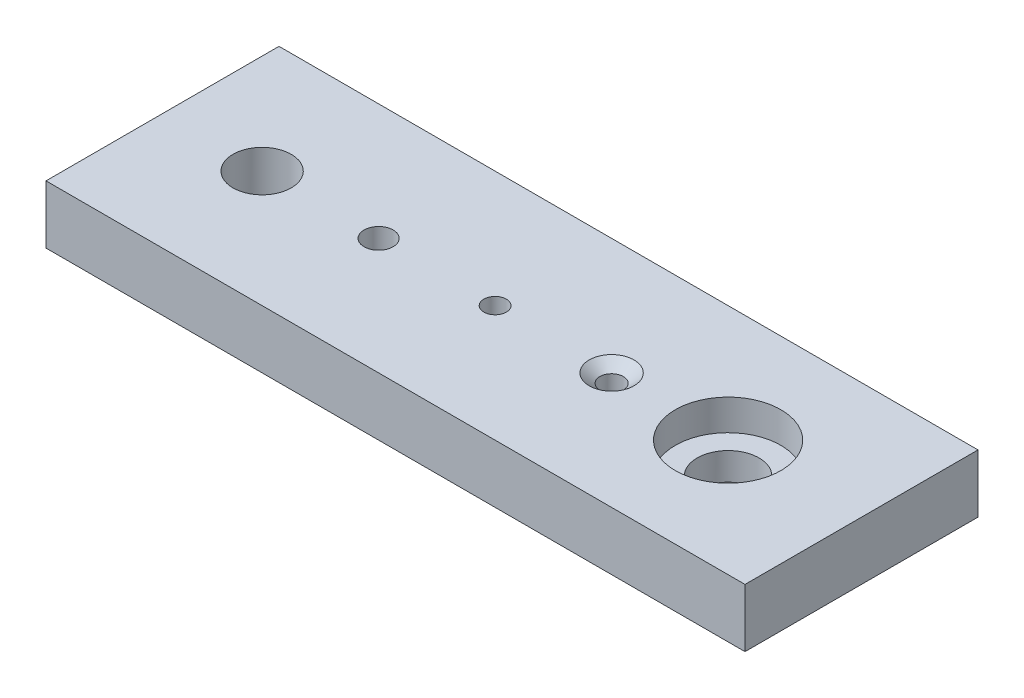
SolidWorks part; units mm, degrees
ref_plane "Front Plane" through (0, 0, 0) normal (0, 0, 1) x (1, 0, 0)
ref_plane "Top Plane" through (0, 0, 0) normal (0, 1, 0) x (1, 0, 0)
ref_plane "Right Plane" through (0, 0, 0) normal (1, 0, 0) x (0, 0, -1)
sketch "Sketch1" plane through (0, 0, 0) normal (0, 1, 0) x (1, 0, 0)
  line L1 (0, 0) -> (152.4, 0)
  line L2 (0, 0) -> (0, 50.8)
  line L3 (0, 50.8) -> (152.4, 50.8)
  line L4 (152.4, 0) -> (152.4, 50.8)
  dimension "D1" = 152.4
  dimension "D2" = 50.8
extrude "Boss-Extrude1" add sketch "Sketch1" along normal blind 12.7
hole_wizard "1/2 (0.5) Diameter Hole1" positions "Sketch3" profile "Sketch2" hole size "1/2" standard "ANSI Inch"
sketch "Sketch3" plane through (0, 12.7, 0) normal (0, 1, 0) x (1, 0, 0)
  line L0 (152.4, 50.8) -> (0, 50.8) construction
  line L1 (0, 50.8) -> (0, 0) construction
  point P0 (21.717, 25.4)
  dimension "D1" = 25.4
  dimension "D2" = 21.717
sketch "Sketch2" plane through (21.717, 12.7, -25.4) normal (1, 0, 0) x (0, 0, 1)
  line L0 (0, 0) -> (0, 12.7)
  line L1 (0, 12.7) -> (6.35, 12.7)
  line L2 (6.35, 12.7) -> (6.35, 0)
  line L5 (6.35, 0) -> (0, 0)
  line L11 (0, -6.35) -> (0, 107.95) construction
  dimension "Thru Hole Dia." = 12.7
  dimension "Thru Hole Depth" = 12.7
hole_wizard "1/4 (0.25) Diameter Hole1" positions "Sketch5" profile "Sketch4" hole size "1/4" standard "ANSI Inch"
sketch "Sketch5" plane through (0, 12.7, 0) normal (0, 1, 0) x (1, 0, 0)
  line L0 (152.4, 50.8) -> (0, 50.8) construction
  circle A0 centre (21.717, 25.4) radius 6.35 construction
  point P0 (47.117, 25.4)
  dimension "D1" = 25.4
  dimension "D2" = 25.4
sketch "Sketch4" plane through (47.117, 12.7, -25.4) normal (1, 0, 0) x (0, 0, 1)
  line L0 (0, 0) -> (0, 40.0077)
  line L1 (0, 40.0077) -> (3.175, 38.1)
  line L2 (3.175, 38.1) -> (3.175, 0)
  line L5 (3.175, 0) -> (0, 0)
  line L10 (0, 40.0077) -> (-3.175, 38.1) construction
  line L11 (0, -6.35) -> (0, 107.95) construction
  dimension "Hole Dia." = 6.35
  dimension "Hole Depth" = 38.1
  dimension "Drill Angle" = 118
hole_wizard "#10 (0.1935) Diameter Hole1" positions "Sketch7" profile "Sketch6" hole size "#10" standard "ANSI Inch"
sketch "Sketch7" plane through (0, 12.7, 0) normal (0, 1, 0) x (1, 0, 0)
  line L0 (152.4, 50.8) -> (0, 50.8) construction
  circle A0 centre (47.117, 25.4) radius 3.175 construction
  point P0 (72.517, 25.4)
  dimension "D1" = 25.4
  dimension "D2" = 25.4
sketch "Sketch6" plane through (72.517, 12.7, -25.4) normal (1, 0, 0) x (0, 0, 1)
  line L0 (0, 0) -> (0, 12.7)
  line L1 (0, 12.7) -> (2.4574, 12.7)
  line L2 (2.4574, 12.7) -> (2.4574, 0)
  line L5 (2.4574, 0) -> (0, 0)
  line L11 (0, -6.35) -> (0, 107.95) construction
  dimension "Thru Hole Dia." = 4.9149
  dimension "Thru Hole Depth" = 12.7
hole_wizard "CSK for #10 Flat Head Machine Screw (100)1" positions "Sketch9" profile "Sketch8" countersink size "#10" standard "ANSI Inch"
sketch "Sketch9" plane through (0, 12.7, 0) normal (0, 1, 0) x (1, 0, 0)
  line L0 (152.4, 50.8) -> (0, 50.8) construction
  circle A0 centre (72.517, 25.4) radius 2.4574 construction
  point P0 (97.917, 25.4)
  dimension "D1" = 25.4
  dimension "D2" = 25.4
sketch "Sketch8" plane through (97.917, 12.7, -25.4) normal (1, 0, 0) x (0, 0, 1)
  line L0 (0, 0) -> (0, 12.7)
  line L1 (0, 12.7) -> (2.5527, 12.7)
  line L2 (2.5527, 12.7) -> (2.5527, 1.9608)
  line L3 (2.5527, 1.9608) -> (4.8895, 0)
  line L5 (4.8895, 0) -> (0, 0)
  line L6 (-2.5527, 1.9608) -> (-4.8895, 0) construction
  line L11 (0, -6.35) -> (0, 107.95) construction
  dimension "Thru Hole Dia." = 5.1054
  dimension "Thru Hole Depth" = 12.7
  dimension "Near C'Sink Dia." = 9.779
  dimension "Near C'Sink Angle" = 100
hole_wizard "CBORE for 1/2 Button Head Cap Screw1" positions "Sketch12" profile "Sketch10" counterbore size "1/2" standard "ANSI Inch"
sketch "Sketch12" plane through (0, 12.7, 0) normal (0, 1, 0) x (1, 0, 0)
  line L0 (152.4, 50.8) -> (0, 50.8) construction
  circle A0 centre (97.917, 25.4) radius 4.8895 construction
  point P0 (123.317, 25.4)
  dimension "D1" = 25.4
  dimension "D2" = 25.4
sketch "Sketch10" plane through (123.317, 12.7, -25.4) normal (1, 0, 0) x (0, 0, 1)
  line L0 (0, 0) -> (0, 12.7)
  line L1 (0, 12.7) -> (6.7462, 12.7)
  line L3 (6.7462, 12.7) -> (6.7462, 6.731)
  line L4 (6.7462, 6.731) -> (11.5075, 6.731)
  line L5 (11.5075, 6.731) -> (11.5075, 0)
  line L7 (11.5075, 0) -> (0, 0)
  line L11 (0, -6.35) -> (0, 107.95) construction
  dimension "Thru Hole Dia." = 13.4925
  dimension "Thru Hole Depth" = 12.7
  dimension "C'Bore Dia." = 23.0149
  dimension "C'Bore Depth" = 6.731
